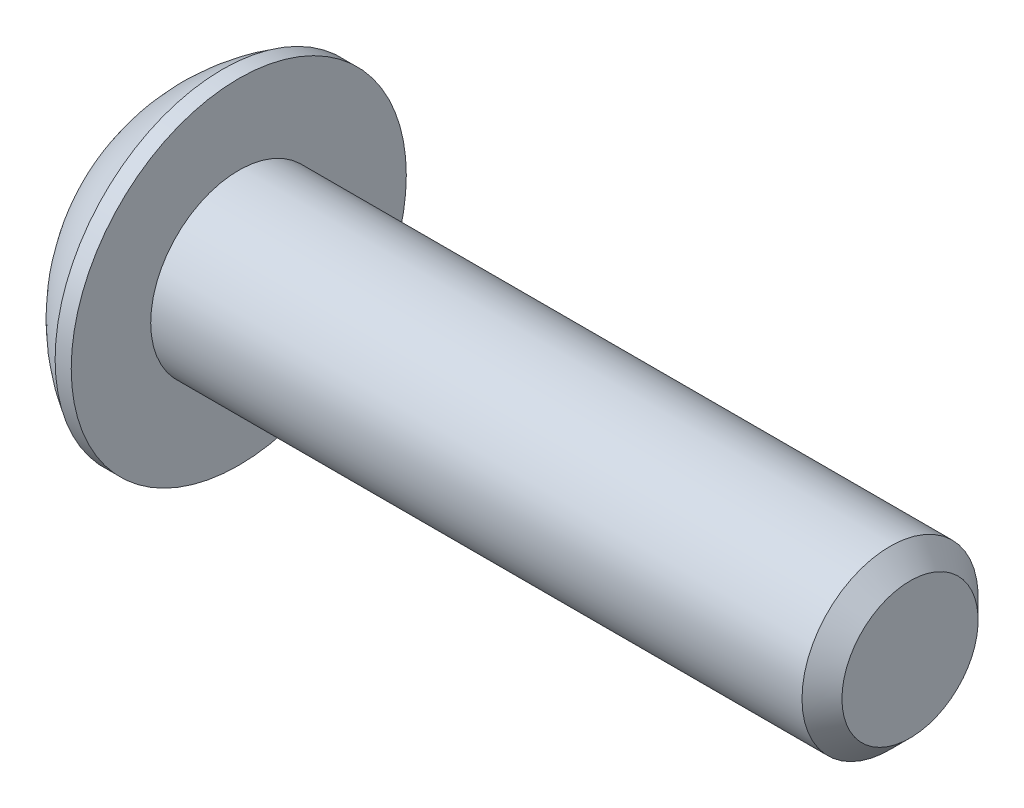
SolidWorks part; units mm, degrees
ref_plane "Plane1" through (0, 0, 0) normal (0, 0, 1) x (1, 0, 0)
ref_plane "Plane2" through (0, 0, 0) normal (0, 1, 0) x (1, 0, 0)
ref_plane "Plane3" through (0, 0, 0) normal (1, 0, 0) x (0, 0, -1)
sketch "BodySke" plane through (0, 0, 0) normal (0, 0, 1) x (1, 0, 0)
  line L0 (18.0848, 0) -> (18.0848, 1.6104)
  line L1 (17.6124, 2.0828) -> (2.2098, 2.0828)
  line L2 (2.2098, 2.0828) -> (2.2098, 3.9624)
  line L3 (2.2098, 3.9624) -> (1.8288, 3.9624)
  line L4 (0, 0) -> (101.6, 0) construction
  line L5 (2.2098, -3.9624) -> (1.8288, -3.9624) construction
  line L6 (55.6768, -2.0828) -> (2.2098, -2.0828) construction
  line L7 (18.0848, 0) -> (0, 0)
  line L8 (0, 1.9812) -> (0, -1.9812) construction
  line L9 (0, 0) -> (0, 1.9812)
  line L10 (18.0848, 1.6104) -> (17.6124, 2.0828)
  line L11 (18.0848, -1.6104) -> (17.6124, -2.0828) construction
  line L12 (3.0023, 9.525) -> (3.0023, -2.0828) construction
  line L13 (2.2098, 9.525) -> (2.2098, -2.0828) construction
  arc A1 (0, 1.9812) -> (1.8288, 3.9624) centre (4.1339, 0) cw
revolve "BaseBody" add sketch "BodySke" angle 360 about L4
sketch "Sketch2" plane through (0, 0, 0) normal (0, 0, 1) x (1, 0, 0)
  line L0 (0, 1.1938) -> (1.3208, 1.1938)
  line L1 (1.3208, 1.1938) -> (2.01, 0)
  line L3 (2.01, 0) -> (0, 0)
  line L4 (0, 0) -> (0, 1.1938)
  line L5 (0, -1.1938) -> (1.3208, -1.1938) construction
  line L6 (0, 0) -> (47.625, 0) construction
  dimension "D2" = 60
  dimension "PreBroach_depth" = 1.3208
  dimension "PreBroach_dia" = 2.3876
revolve "PreBroach" cut sketch "Sketch2" angle 360 about L6
sketch "Sketch3" plane through (0, 0, 0) normal (1, 0, 0) x (0, 0, -1)
  line L0 (-1.1938, -0.6892) -> (-1.1938, 0.6892)
  line L1 (-1.1938, 0.6892) -> (0, 1.3785)
  line L2 (0, 1.3785) -> (1.1938, 0.6892)
  line L3 (1.1938, 0.6892) -> (1.1938, -0.6892)
  line L4 (1.1938, -0.6892) -> (0, -1.3785)
  line L5 (0, -1.3785) -> (-1.1938, -0.6892)
extrude "Hex" cut sketch "Sketch3" along normal blind 1.3208
sketch "Sketch4" plane through (0, 9.525, 0) normal (1, 0, 0) x (0, 0, -1)
  line L0 (0, -9.525) -> (1.4605, -9.525)
  line L1 (0, -9.525) -> (6.1484, -5.9752) construction
  line L2 (0, -9.525) -> (0.7302, -8.2602)
  line L3 (1.2009, -9.1983) -> (1.3933, -9.0872)
  line L4 (0.8834, -8.6483) -> (1.0758, -8.5373)
  arc A0 (1.2009, -9.1983) -> (0.8834, -8.6483) centre (0, -9.525) ccw
  arc A1 (1.4605, -9.525) -> (1.3933, -9.0872) centre (0, -9.525) ccw
  arc A2 (0.7302, -8.2602) -> (1.0758, -8.5373) centre (0, -9.525) cw
extrude "Spline" [suppressed] cut sketch "Sketch4" along normal blind 1.3208
pattern_circular "CirPattern1" [suppressed] count 6 every 60 about axis through (0, 0, 0) along (1, 0, 0)
sketch "ThdSchSke" plane through (0, 0, 0) normal (0, 0, 1) x (1, 0, 0)
  line L0 (3.0023, -1.6104) -> (2.6715, -2.0828)
  line L1 (3.0023, -1.6104) -> (3.3331, -2.0828)
  line L2 (3.3331, -2.0828) -> (3.3331, -2.6035)
  line L3 (-3.175, 0) -> (5.1513, 0) construction
  line L5 (3.3331, -2.6035) -> (2.6715, -2.6035)
  line L6 (2.6715, -2.6035) -> (2.6715, -2.0828)
revolve "ThreadSchematic" [suppressed] cut sketch "ThdSchSke" angle 360 about L3
pattern_linear "ThdSchPat" [suppressed]
equation "\"D1@BodySke\" = \"Head_dia@BodySke\" * .5"
equation "\"Thread_minor@ThreadCosmetic\" = \"Minor_dia@BodySke\""
equation "\"D1@Sketch3\" = \"Hex_size@Sketch3\" / 2"
equation "\"D2@Sketch3\" = \"D1@Sketch3\""
equation "\"D3@Sketch3\" = \"Hex_size@Sketch3\""
equation "\"D3@Sketch4\" = \"Spline_p_dim@Sketch4\" / 2"
equation "\"D1@Sketch4\" = \"D2@Sketch4\" / 2"
equation "\"Thread_length@ThreadCosmetic\" = ((sgn( (\"Length@BodySke\" - \"Advance@BodySke\" ) - \"Thread_nom@BodySke\" )-1)*( (\"Length@BodySke\" - \"Advance@BodySke\" ) - \"Thread_nom@BodySke\" ))/-2+ \"Thread_nom@BodySke\""
equation "\"Thread_minor@ThdSchSke\" = \"Minor_dia@BodySke\""
equation "\"Diameter@ThdSchSke\" = \"Diameter@BodySke\""
equation "\"Overcut@ThdSchSke\" = \"Diameter@BodySke\" * 1.25"
equation "\"Start@ThdSchSke\" = \"Head_ht@BodySke\" + \"Length@BodySke\" - \"Thread_length@ThreadCosmetic\"  '---Non-countersunk---"
equation "\"Num_threads@ThdSchPat\" = int( \"Thread_length@ThreadCosmetic\" / \"Advance@BodySke\" + 0.999 )  + 1"
equation "\"Advance@ThdSchPat\" = \"Thread_length@ThreadCosmetic\" /  (\"Num_threads@ThdSchPat\" - 1) 'relax it"
equation "\"Num_threads@ThdSchPat\" = \"Num_threads@ThdSchPat\" - sgn( \"Num_threads@ThdSchPat\" - 1) '---chamfered tips only---"
